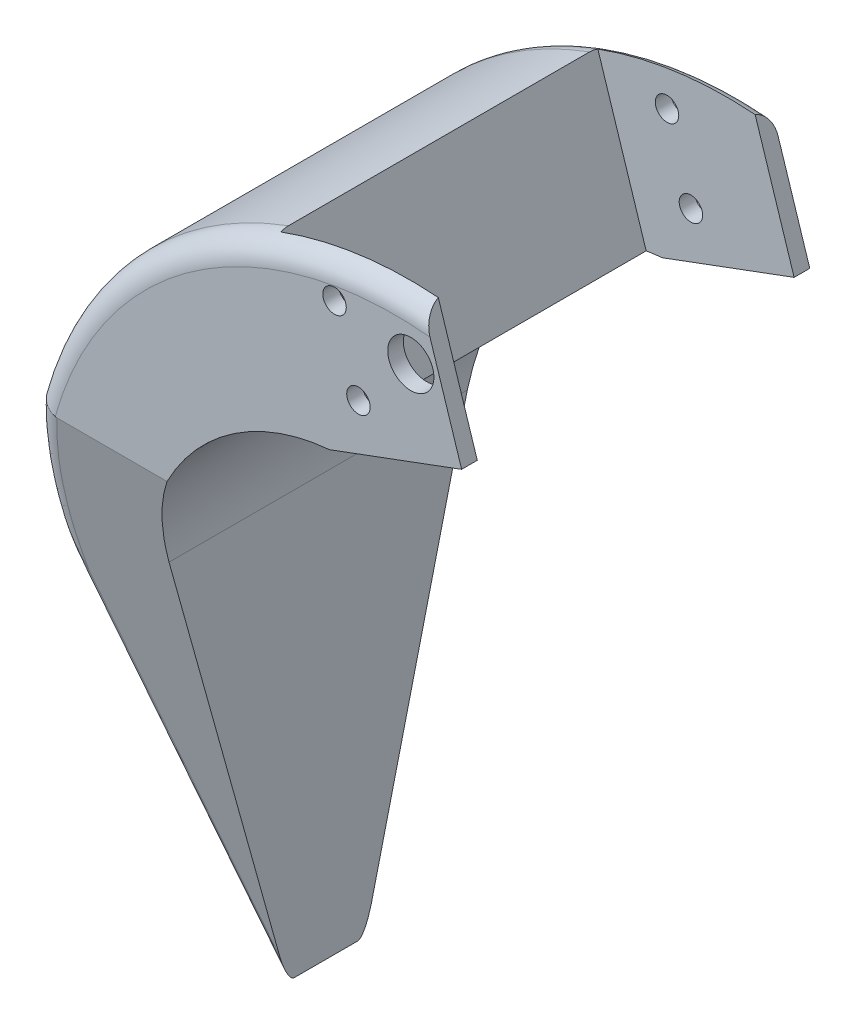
SolidWorks part; units mm, degrees
ref_plane "Alzado" through (0, 0, 0) normal (0, 0, 1) x (1, 0, 0)
ref_plane "Planta" through (0, 0, 0) normal (0, 1, 0) x (1, 0, 0)
ref_plane "Vista lateral" through (0, 0, 0) normal (1, 0, 0) x (0, 0, -1)
sketch "Croquis1" plane through (0, 0, 0) normal (0, 0, 1) x (1, 0, 0)
  line L0 (39.5879, 32.1597) -> (22.7117, 25.8991)
  line L2 (0, -53) -> (-17, 0)
  line L3 (0, -55) -> (0, 55) construction
  line L4 (55, 0) -> (-55, 0) construction
  line L5 (16.3395, 45.7063) -> (33.4794, 51.204)
  line L6 (33.4794, 51.204) -> (39.5879, 32.1597)
  line L7 (-1, 0) -> (0, -53)
  arc A0 (-17, 0) -> (16.3395, 45.7063) centre (31, 0) cw
  arc A1 (-1, 0) -> (22.7117, 25.8991) centre (25, 0) cw
  point P8 (14.3606, 23.0895)
  point P12 (0, 0)
  point P15 (36.1009, 30.8906)
  point P16 (0, 0)
  point P17 (39.9298, 32.268)
  dimension "D1" = 48
  dimension "D2" = 26
  dimension "D4" = 18
  dimension "D5" = 20
  dimension "D3" = 53
  dimension "D6" = 25
  dimension "D7" = 31
extrude "Saliente-Extruir1" add sketch "Croquis1" along normal blind 44.5
sketch "Croquis2" plane through (-11.7687, 36.6905, 0) normal (-0.3054, 0.9522, 0) x (0.9522, 0.3054, 0)
  line L0 (47.5187, -44.5) -> (47.5187, 0) construction
  line L1 (47.5187, -42.5) -> (27.5187, -42.5)
  line L2 (47.5187, -42.5) -> (47.5187, -2)
  line L3 (47.5187, -2) -> (27.5187, -2)
  line L4 (27.5187, -42.5) -> (27.5187, -2)
  line L6 (-55, 0) -> (55, 0) construction
  line L7 (47.5187, -44.5) -> (29.5187, -44.5) construction
  dimension "D1" = 2
  dimension "D2" = 2
  dimension "D3" = 20
extrude "Cortar-Extruir1" cut sketch "Croquis2" against normal up to surface (20.8976 mm away)
sketch "Croquis3" plane through (0, 0, 2) normal (0, 0, 1) x (1, 0, 0)
  line L0 (39.5879, 32.1597) -> (33.4794, 51.204) construction
  line L2 (36.5336, 41.6819) -> (24.8005, 37.9184) construction
  circle A0 centre (23.3419, 42.7015) radius 1.5
  circle A2 centre (26.3961, 33.1793) radius 1.5
  point P6 (23.3419, 42.7015)
  dimension "D2" = 3
  dimension "D3" = 5
  dimension "D1" = 12.25
extrude "Cortar-Extruir2" cut sketch "Croquis3" against normal through all and the other way through all
sketch "Croquis4" plane through (0, 0, 44.5) normal (0, 0, 1) x (1, 0, 0)
  line L0 (36.5336, 41.6819) -> (23.541, 37.5144) construction
  line L1 (39.5879, 32.1597) -> (33.4794, 51.204) construction
  circle A0 centre (33.0919, 40.5779) radius 2.95
  circle A1 centre (23.3419, 42.7015) radius 1.5 construction
  point P6 (0, 0)
  dimension "D1" = 5.9
  dimension "D2" = 9.75
extrude "Cortar-Extruir4" cut sketch "Croquis4" against normal up to surface (2 mm away) contours A0
ref_plane "Plano1" through (-17, 0, 0) normal (1, 0, 0) x (0, 0, -1)
sketch "Croquis5" plane through (-17, 0, 0) normal (1, 0, 0) x (0, 0, -1)
  line L0 (-17.25, -53) -> (0, 12)
  line L1 (-44.5, -53) -> (0, -53) construction
  line L2 (0, 31.1233) -> (0, -31.1233) construction
  line L3 (0, 12) -> (0, -53)
  line L4 (0, -53) -> (-17.25, -53)
  line L10 (-22.25, -64.3688) -> (-22.25, 50.9001) construction
  line L11 (-44.5, 12) -> (-44.5, -53)
  line L12 (-27.25, -53) -> (-44.5, 12)
  line L13 (-44.5, -53) -> (-27.25, -53)
  dimension "D1" = 22.25
  dimension "D2" = 5
  dimension "D3" = 65
extrude "Cortar-Extruir5" cut sketch "Croquis5" along normal blind 19
fillet "Redondeo3" radius 1 2 edges at (-8.5, -26.5, 34.2827) (-8.5, -26.5, 10.2173)
fillet "Redondeo6" radius 3 7 edges at (-16.9998, 0.1397, 3.8059) (-17, 0, 22.25) (-16.9997, 0.1559, 40.7146) (-16.4231, 7.4195, 1.2156) (-3.9062, 32.9478, 0) (-3.9062, 32.9478, 44.5) (-16.4231, 7.4195, 43.2844)
